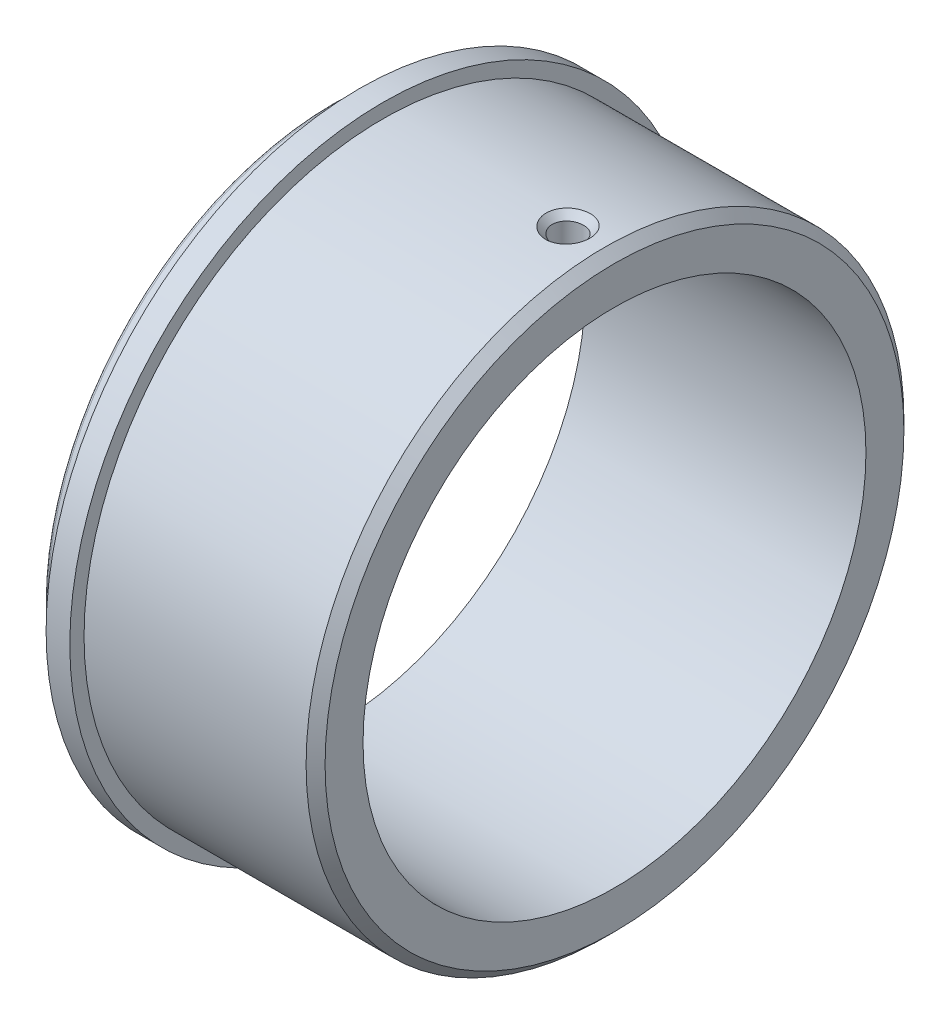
SolidWorks part; units mm, degrees
ref_plane "Vorne" through (0, 0, 0) normal (0, 0, 1) x (1, 0, 0)
ref_plane "Oben" through (0, 0, 0) normal (0, 1, 0) x (1, 0, 0)
ref_plane "Rechts" through (0, 0, 0) normal (1, 0, 0) x (0, 0, -1)
sketch "Skizze1" plane through (0, 0, 0) normal (0, 0, 1) x (1, 0, 0)
  line L0 (0, 0) -> (18.4302, 0) construction
  line L1 (0.4, 26.5) -> (30, 26.5)
  line L2 (0.4, 26.5) -> (0.4, 30.1949)
  line L3 (5.6, 31.5) -> (30, 31.5)
  line L4 (30, 26.5) -> (30, 31.5)
  line L5 (2.9, 30) -> (2.1, 30)
  line L6 (3.1, 31.5) -> (3.1, 30.2)
  line L8 (0.6518, 30.3881) -> (2.1, 30)
  line L10 (3.1, 31.5) -> (3.1, 33)
  line L11 (3.1, 33) -> (5.6, 33)
  line L12 (5.6, 31.5) -> (5.6, 33)
  circle A0 centre (1.6, 31.5) radius 1.5 construction
  arc A1 (2.9, 30) -> (3.1, 30.2) centre (2.9, 30.2) ccw
  arc A2 (0.6518, 30.3881) -> (0.4, 30.1949) centre (0.6, 30.1949) ccw
  dimension "D8" = 3
  dimension "D10" = 1
  dimension "D7" = 0.2
  dimension "D9" = 0.2
  dimension "D1" = 26.5
  dimension "D2" = 31.5
  dimension "D3" = 30
  dimension "D4" = 31.5
  dimension "D5" = 0.4
  dimension "D6" = 1.2
  dimension "D11" = 15
  dimension "D12" = 30
  dimension "D13" = 2.5
  dimension "D14" = 33
revolve "Rotation1" add sketch "Skizze1" angle 360 about L0
hole_wizard "M4 Gewindebohrung1" positions "3D-Skizze3" profile "Skizze5" tap size "M4" standard "ISO"
sketch3d "3D-Skizze3"
  line L0 (25.1, 31.5, 0) -> (25.1, 0, 0) construction
  line L2 (30, 0, 0) -> (0.4, 0, 0) construction
  circle A0 centre (0.4, 0, 0) radius 30.1949 construction
  point P0 (25.1, 31.5, 0)
  point P2 (-80.1686, -14.6568, 0)
  point P13 (-29.7949, 0, 0)
  dimension "D1" = 24.7
sketch "Skizze5" plane through (25.1, 31.5, 0) normal (1, 0, 0) x (0, 0, 1)
  line L0 (0, 0) -> (0, 5)
  line L1 (0, 5) -> (1.65, 5)
  line L2 (1.65, 5) -> (1.65, 0)
  line L5 (1.65, 0) -> (0, 0)
  line L11 (0, -6.35) -> (0, 107.95) construction
  dimension "Bohrerdurchmesser" = 3.3
  dimension "Bohrungstiefe" = 5
chamfer "Fase2" distance 0.75 angle 45 1 edges at (25.477, 31.459, -1.6064)
chamfer "Fase3" distance 1 angle 45 1 edges at (30, 0, 31.5)
